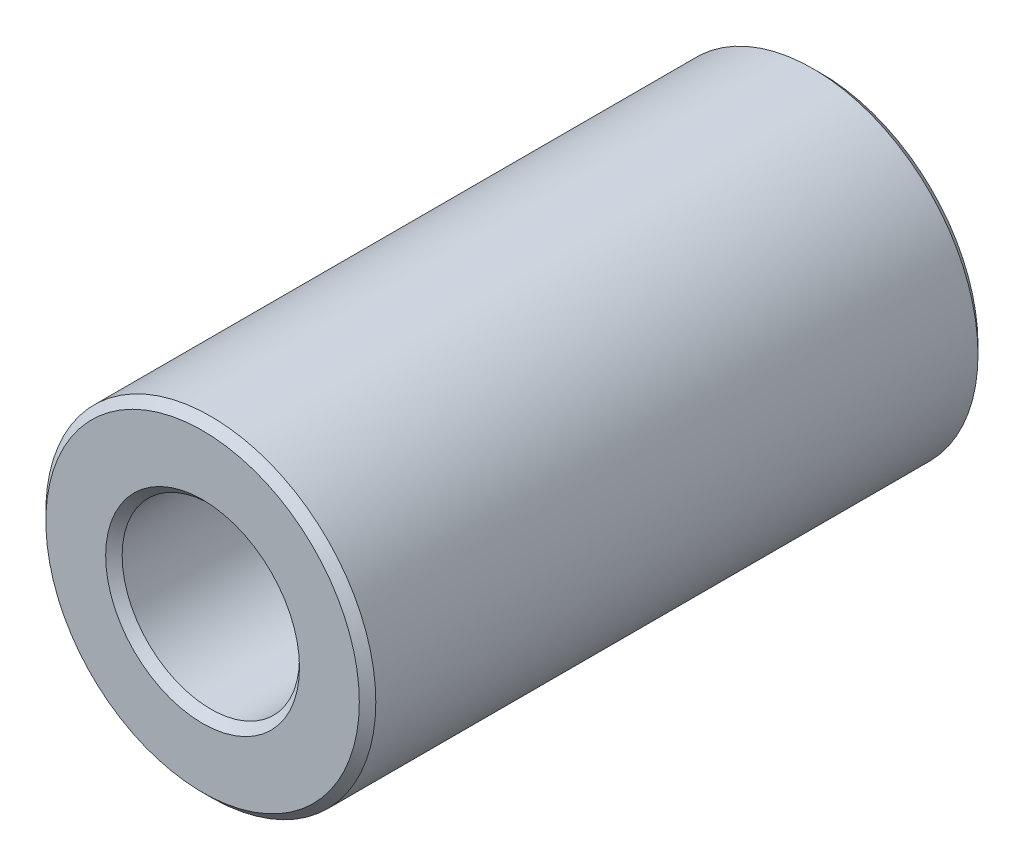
SolidWorks part; units mm, degrees
ref_plane "Front Plane" through (0, 0, 0) normal (0, 0, 1) x (1, 0, 0)
ref_plane "Top Plane" through (0, 0, 0) normal (0, 1, 0) x (1, 0, 0)
ref_plane "Right Plane" through (0, 0, 0) normal (1, 0, 0) x (0, 0, -1)
sketch "Sketch1" plane through (0, 0, 0) normal (0, 0, 1) x (1, 0, 0)
  circle A0 centre (0, 0) radius 4
  circle A1 centre (0, 0) radius 2.15
  dimension "D1" = 8
  dimension "D2" = 4.3
extrude "Boss-Extrude2" add sketch "Sketch1" along normal mid plane 15
chamfer "Chamfer3" distance 0.2 angle 45 4 edges at (4, 0, 7.5) (4, 0, -7.5) (2.15, 0, -7.5) (2.15, 0, 7.5)
